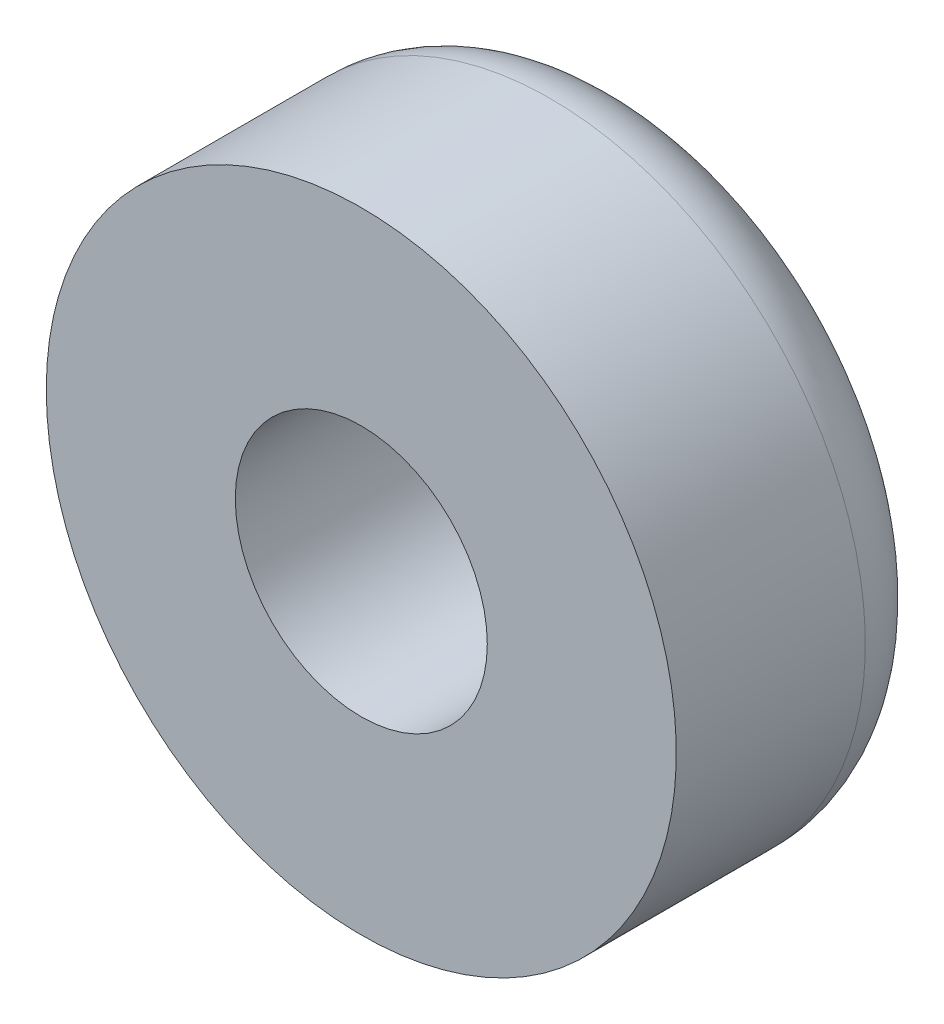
SolidWorks part; units mm, degrees
ref_plane "Face" through (0, 0, 0) normal (0, 0, 1) x (1, 0, 0)
ref_plane "Dessus" through (0, 0, 0) normal (0, 1, 0) x (1, 0, 0)
ref_plane "Droite" through (0, 0, 0) normal (1, 0, 0) x (0, 0, -1)
imported_body "Surface-Importée1"
imported_body "Surface-Importée2"
imported_body "Surface-Importée3"
imported_body "Surface-Importée4"
imported_body "Surface-Importée5"
sketch "Esquisse1" plane through (0, 0, -302) normal (0, 0, -1) x (-1, 0, 0)
  circle A0 centre (4.5313, 29.375) radius 20
  circle A1 centre (4.5313, 29.375) radius 20 construction
extrude "Extrusion1" add sketch "Esquisse1" along normal blind 17
fillet "Congé1" radius 5
sketch "Esquisse2" plane through (0, 0, -319) normal (0, 0, -1) x (-1, 0, 0)
  circle A0 centre (4.5313, 29.375) radius 8
  circle A1 centre (4.5313, 29.375) radius 20 construction
extrude "Enlèv. mat.-Extru.1" cut sketch "Esquisse2" against normal blind 30
